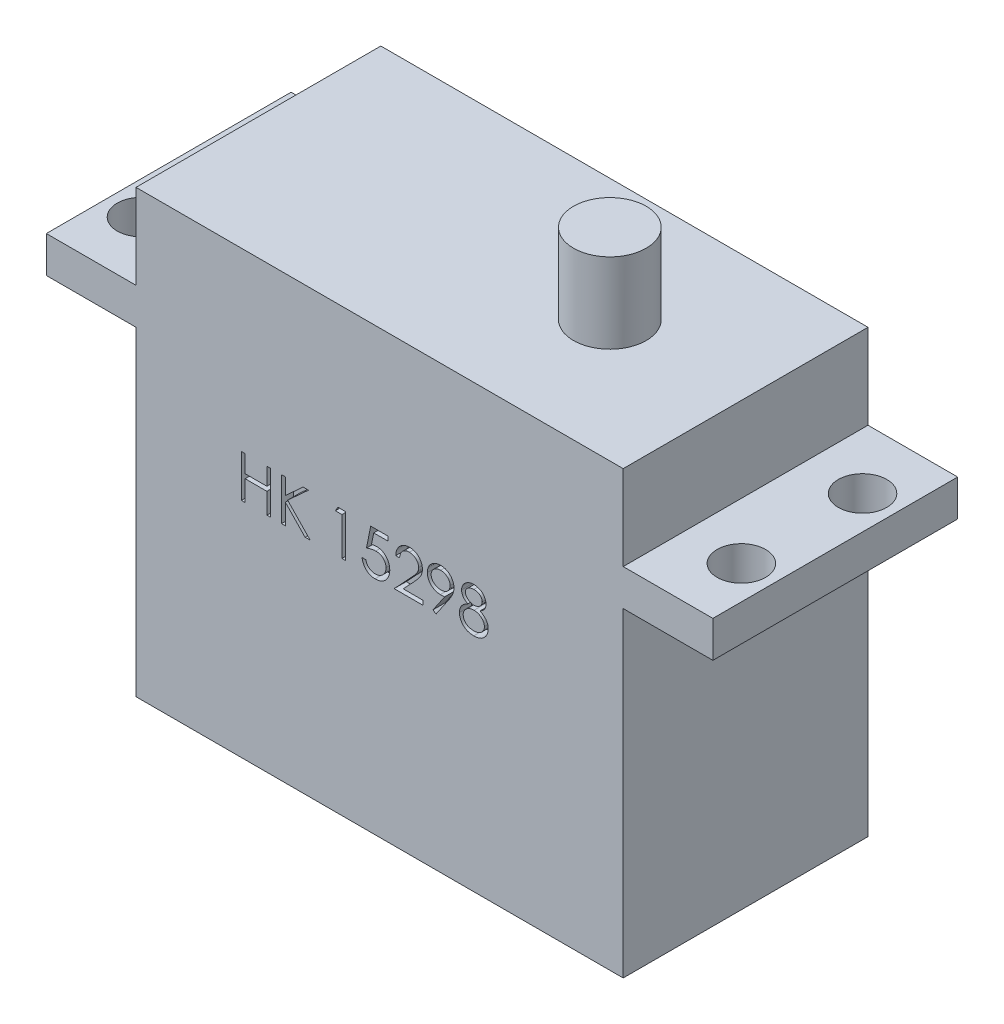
SolidWorks part; units mm, degrees
ref_plane "Plan de face" through (0, 0, 0) normal (0, 0, 1) x (1, 0, 0)
ref_plane "Plan de dessus" through (0, 0, 0) normal (0, 1, 0) x (1, 0, 0)
ref_plane "Plan de droite" through (0, 0, 0) normal (1, 0, 0) x (0, 0, -1)
sketch "Esquisse1" plane through (0, 0, 0) normal (0, 0, 1) x (1, 0, 0)
  line L0 (0, 29.4) -> (0, 36.4)
  line L1 (0, 0) -> (40.2, 0)
  line L2 (0, 0) -> (0, 26.4)
  line L3 (0, 36.4) -> (40.2, 36.4)
  line L4 (40.2, 0) -> (40.2, 26.4)
  line L5 (-7.4, 29.4) -> (0, 29.4)
  line L6 (-7.4, 29.4) -> (-7.4, 26.4)
  line L7 (-7.4, 26.4) -> (0, 26.4)
  line L8 (47.6, 29.4) -> (47.6, 26.4)
  line L9 (40.2, 29.4) -> (47.6, 29.4)
  line L10 (40.2, 29.4) -> (40.2, 36.4)
  line L11 (40.2, 26.4) -> (47.6, 26.4)
extrude "Boss.-Extru.1" add sketch "Esquisse1" along normal blind 20.2
sketch "Esquisse2" plane through (0, 29.4, 0) normal (0, 1, 0) x (1, 0, 0)
  line L0 (-4.65, 4.891) -> (-4.65, -24.3978) construction
  line L1 (-7.4, -10.1) -> (47.6, -10.1) construction
  line L2 (-7.4, -20.2) -> (-7.4, 0) construction
  line L3 (47.6, -20.2) -> (47.6, 0) construction
  line L4 (-10.1854, -5.1) -> (4.4591, -5.1) construction
  line L6 (20.1, 0) -> (20.1, -20.2) construction
  line L7 (40.2, 0) -> (0, 0) construction
  line L8 (40.2, -20.2) -> (0, -20.2) construction
  circle A0 centre (-4.65, -5.1) radius 2
  circle A1 centre (-4.65, -15.1) radius 2
  circle A2 centre (44.85, -15.1) radius 2
  circle A3 centre (44.85, -5.1) radius 2
extrude "Enlèv. mat.-Extru.1" cut sketch "Esquisse2" against normal through all
sketch "Esquisse3" plane through (0, 36.4, 0) normal (0, 1, 0) x (1, 0, 0)
  line L0 (0, -10.1) -> (40.2, -10.1) construction
  line L2 (0, -20.2) -> (0, 0) construction
  line L3 (40.2, -20.2) -> (40.2, 0) construction
  circle A0 centre (29, -10.1) radius 3
  dimension "D1" = 29
  dimension "D2" = 6
extrude "Boss.-Extru.2" add sketch "Esquisse3" along normal blind 6.6
sketch "Esquisse4" plane through (0, 0, 20.2) normal (0, 0, 1) x (1, 0, 0)
  text T0 "HK 15298"
extrude "Enlèv. mat.-Extru.2" cut sketch "Esquisse4" against normal blind 1
equation "\"D5@Esquisse1\"=(\"D4@Esquisse1\"-\"D1@Esquisse1\")/2"
equation "\"D2@Esquisse2\"=49.5/2"
